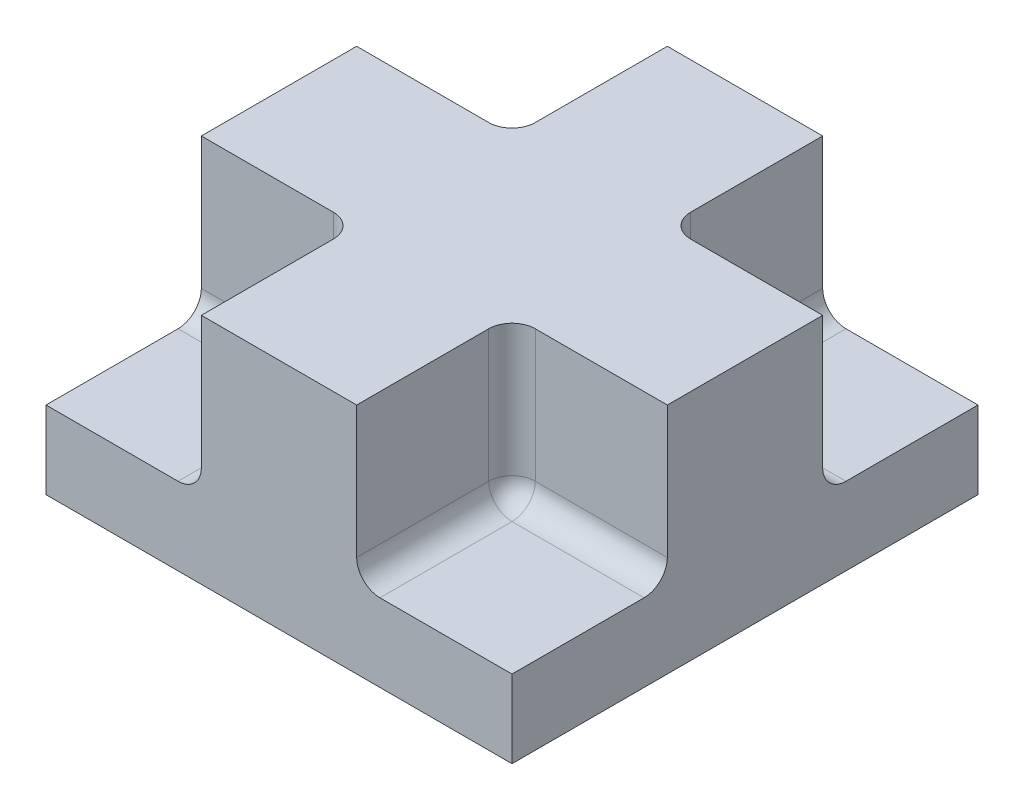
SolidWorks part; units mm, degrees
ref_plane "Front Plane" through (0, 0, 0) normal (0, 0, 1) x (1, 0, 0)
ref_plane "Top Plane" through (0, 0, 0) normal (0, 1, 0) x (1, 0, 0)
ref_plane "Right Plane" through (0, 0, 0) normal (1, 0, 0) x (0, 0, -1)
sketch "Sketch1" plane through (0, 0, 0) normal (0, 1, 0) x (1, 0, 0)
  line L1 (0, 0) -> (60, 0)
  line L2 (0, 0) -> (0, 60)
  line L3 (0, 60) -> (60, 60)
  line L4 (60, 0) -> (60, 60)
  dimension "D1" = 60
  dimension "D2" = 60
extrude "Extrude1" add sketch "Sketch1" along normal blind 30
sketch "Sketch2" plane through (0, 30, 0) normal (0, 1, 0) x (-1, 0, 0)
  line L1 (0, 0) -> (-20, 0)
  line L2 (0, 0) -> (0, -20)
  line L3 (0, -20) -> (-20, -20)
  line L4 (-20, 0) -> (-20, -20)
  line L5 (0, -60) -> (-20, -60)
  line L6 (0, -60) -> (0, -40)
  line L7 (0, -40) -> (-20, -40)
  line L8 (-20, -60) -> (-20, -40)
  line L9 (-60, -60) -> (-40, -60)
  line L10 (-60, -60) -> (-60, -40)
  line L11 (-60, -40) -> (-40, -40)
  line L12 (-40, -60) -> (-40, -40)
  line L13 (-60, 0) -> (-40, 0)
  line L14 (-60, 0) -> (-60, -20)
  line L15 (-60, -20) -> (-40, -20)
  line L16 (-40, 0) -> (-40, -20)
  dimension "D1" = 20
extrude "Cut-Extrude1" cut sketch "Sketch2" against normal blind 20
fillet "Fillet1" radius 3 12 edges at (20, 20, -20) (10, 10, -20) (20, 10, -10) (20, 20, -40) (20, 10, -50) (10, 10, -40) (40, 20, -40) (50, 10, -40) (40, 10, -50) (40, 20, -20) (40, 10, -10) (50, 10, -20)
